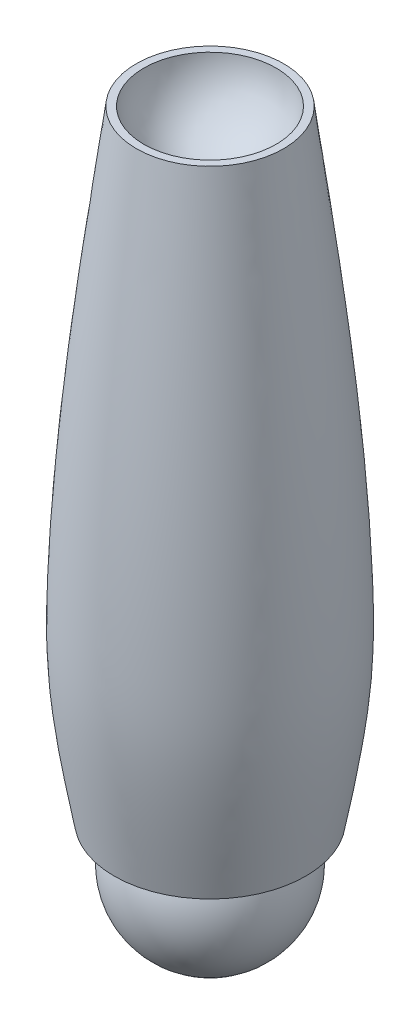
SolidWorks part; units mm, degrees
ref_plane "Plan de face" through (0, 0, 0) normal (0, 0, 1) x (1, 0, 0)
ref_plane "Plan de dessus" through (0, 0, 0) normal (0, 1, 0) x (1, 0, 0)
ref_plane "Plan de droite" through (0, 0, 0) normal (1, 0, 0) x (0, 0, -1)
sketch "Esquisse1" plane through (0, 0, 0) normal (0, 0, 1) x (1, 0, 0)
  line L0 (0, 301.0672) -> (0, -61.7465) construction
  line L1 (0, 0) -> (-39, 0)
  line L2 (0, 252) -> (0, 0)
  line L3 (-30, 252) -> (0, 252)
  spline_without_curve S0
  dimension "D1" = 252
  dimension "D2" = 78
  dimension "D3" = 60
revolve "Révolution1" add sketch "Esquisse1" angle 360 about L2
sketch "Esquisse2" plane through (0, 0, 0) normal (0, 0, 1) x (1, 0, 0)
  line L0 (0, -78.1027) -> (0, 156.4511) construction
  line L1 (0, 18) -> (0, -48)
  arc A0 (0, -48) -> (0, 18) centre (0, -15) ccw
  dimension "D1" = 66
  dimension "D2" = 15
revolve "Révolution2" add sketch "Esquisse2" angle 360 about L0
sketch "Esquisse3" plane through (0, 0, 0) normal (0, 0, 1) x (1, 0, 0)
  line L0 (0, 0) -> (0, 347.0701) construction
  line L1 (30, 252) -> (-30, 252) construction
  line L2 (0, 227) -> (0, 281)
  arc A0 (0, 227) -> (0, 281) centre (0, 254) ccw
  dimension "D1" = 54
  dimension "D2" = 2
revolve "Enlèvement de matière-Révolution1" cut sketch "Esquisse3" angle 360 about L0
